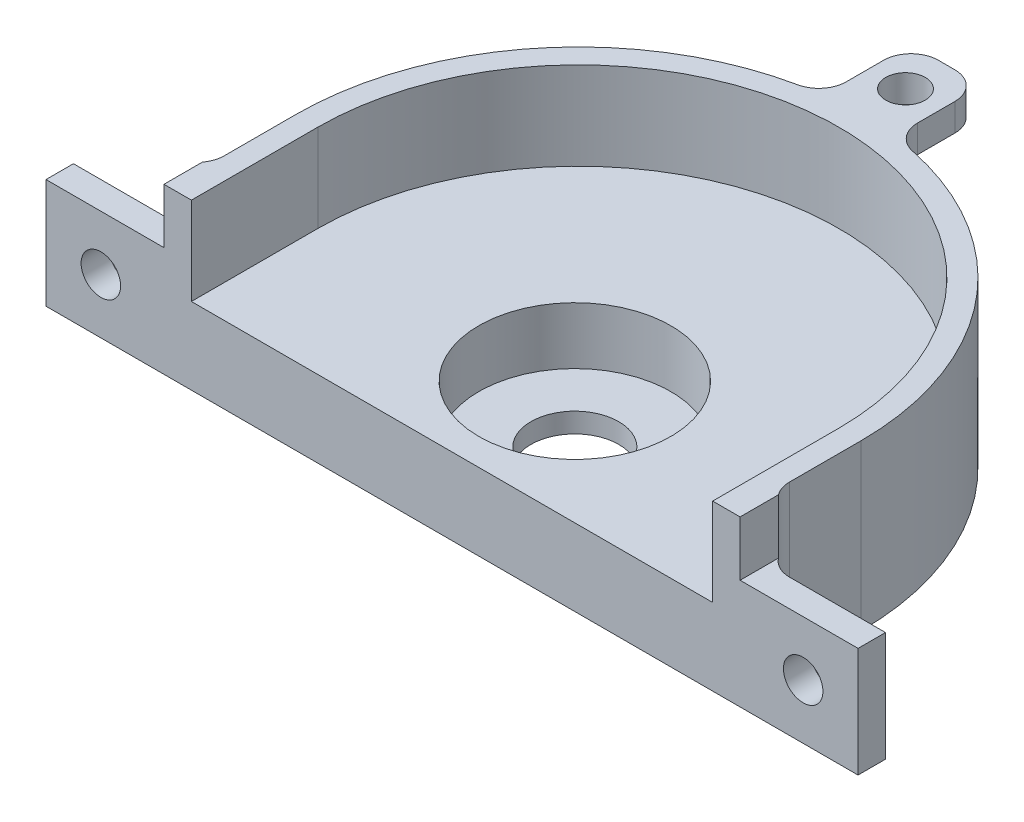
SolidWorks part; units mm, degrees
ref_plane "Front Plane" through (0, 0, 0) normal (0, 0, 1) x (1, 0, 0)
ref_plane "Top Plane" through (0, 0, 0) normal (0, 1, 0) x (1, 0, 0)
ref_plane "Right Plane" through (0, 0, 0) normal (1, 0, 0) x (0, 0, -1)
sketch "Sketch1" plane through (0, 0, 0) normal (0, 1, 0) x (1, 0, 0)
  line L0 (0, 61.1282) -> (0, -58.0946) construction
  line L1 (-60.2181, 0) -> (59.6114, 0) construction
  line L2 (-50.8, -38.1) -> (50.8, -38.1)
  line L4 (-50.8, -38.1) -> (-50.8, 38.1)
  line L5 (-50.8, 38.1) -> (50.8, 38.1)
  line L6 (50.8, -38.1) -> (50.8, 38.1)
  dimension "D1" = 76.2
  dimension "D2" = 101.6
  dimension "D3" = 50.8
extrude "Extrude1" add sketch "Sketch1" along normal blind 19.05
sketch "Sketch2" plane through (0, 19.05, 0) normal (0, 1, 0) x (1, 0, 0)
  line L1 (-50.8, -38.1) -> (50.8, -38.1) construction
  line L4 (-30.1625, -22.333) -> (-30.1625, -46.1454)
  line L5 (-30.1625, -46.1454) -> (30.1625, -46.1455)
  line L6 (30.1625, -22.3329) -> (30.1625, -46.1455)
  arc A0 (30.1625, -22.3329) -> (-30.1625, -22.333) centre (0, -22.333) ccw
  circle A1 centre (0, -22.333) radius 3.175 construction
  dimension "D2" = 60.325
  dimension "D3" = 6.35
  dimension "D1" = 15.7671
extrude "Cut-Extrude1" cut sketch "Sketch2" against normal blind 10.16
sketch "Sketch4" plane through (0, 0, 0) normal (0, 1, 0) x (1, 0, 0)
  line L0 (-30.1625, -38.1) -> (30.1625, -38.1) construction
  circle A0 centre (0, -22.7457) radius 5.08
  dimension "D2" = 10.16
  dimension "D1" = 15.3543
extrude "Cut-Extrude2" cut sketch "Sketch4" along normal through all
sketch "Sketch5" plane through (0, 19.05, 0) normal (0, 1, 0) x (1, 0, 0)
  line L0 (-50.8, -33.782) -> (-35.8775, -33.782)
  line L1 (-50.8, 38.1) -> (-50.8, -38.1) construction
  line L2 (-32.7025, -30.607) -> (-32.7025, -22.333)
  line L3 (0, -38.3038) -> (0, 44.9227) construction
  line L4 (-30.1625, -22.333) -> (-30.1625, -38.1) construction
  line L5 (-50.8, -33.782) -> (-50.8, -36.957)
  line L6 (-50.8, -36.957) -> (-30.1625, -36.957)
  line L7 (-30.1625, -22.3329) -> (-30.1625, -38.1) construction
  line L8 (-30.1625, -36.957) -> (30.1625, -36.957)
  line L9 (4.1275, 20.2865) -> (4.1275, 12.7935)
  line L10 (50.8, -36.957) -> (30.1625, -36.957)
  line L11 (50.8, -33.782) -> (50.8, -36.957)
  line L12 (32.7025, -30.607) -> (32.7025, -22.333)
  line L13 (50.8, -33.782) -> (35.8775, -33.782)
  line L14 (30.1625, -38.1) -> (50.8, -38.1) construction
  line L15 (-4.1275, 20.2865) -> (4.1275, 20.2865)
  line L16 (-4.1275, 20.2865) -> (-4.1275, 12.7935)
  arc A0 (-32.7025, -22.333) -> (-6.6563, 9.685) centre (0, -22.333) cw
  arc A1 (-32.7025, -30.607) -> (-35.8775, -33.782) centre (-35.8775, -30.607) cw
  arc A2 (30.1625, -22.3329) -> (-30.1625, -22.3329) centre (0, -22.333) ccw construction
  arc A3 (32.7025, -30.607) -> (35.8775, -33.782) centre (35.8775, -30.607) ccw
  arc A4 (32.7025, -22.333) -> (6.6563, 9.685) centre (0, -22.333) ccw
  arc A5 (-4.1275, 12.7935) -> (-6.6563, 9.685) centre (-7.3025, 12.7935) cw
  arc A6 (4.1275, 12.7935) -> (6.6563, 9.685) centre (7.3025, 12.7935) ccw
  point P37 (0, 20.2865)
  point P38 (-32.7025, -33.782)
  point P41 (32.7025, -33.782)
  dimension "D1" = 2.54
  dimension "D4" = 3.175
  dimension "D7" = 3.175
  dimension "D8" = 3.175
  dimension "D2" = 1.143
  dimension "D3" = 3.175
  dimension "D5" = 4.1275
  dimension "D6" = 7.493
extrude "Cut-Extrude3" cut sketch "Sketch5" against normal through all flip side to cut
sketch "Sketch6" plane through (0, 8.89, 0) normal (0, 1, 0) x (1, 0, 0)
  line L1 (18.4342, -35.3695) -> (26.9875, -35.3695)
  line L2 (-30.1625, -22.333) -> (-30.1625, -32.1945)
  line L3 (-26.9875, -35.3695) -> (-15.875, -35.3695)
  line L4 (30.1625, -22.333) -> (30.1625, -32.1945)
  line L5 (-30.1625, -36.957) -> (30.1625, -36.957) construction
  line L6 (15.9788, -33.4795) -> (12.2771, -19.4958)
  line L7 (-12.7, -32.1945) -> (-12.7, -22.7457)
  circle A0 centre (0, -22.7457) radius 11.1125
  arc A1 (12.2771, -19.4958) -> (-12.7, -22.7457) centre (0, -22.7457) ccw
  arc A2 (-30.1625, -22.333) -> (30.1625, -22.333) centre (0, -22.333) cw
  arc A3 (15.9788, -33.4795) -> (18.4342, -35.3695) centre (18.4342, -32.8295) ccw
  arc A4 (26.9875, -35.3695) -> (30.1625, -32.1945) centre (26.9875, -32.1945) ccw
  arc A5 (-12.7, -32.1945) -> (-15.875, -35.3695) centre (-15.875, -32.1945) cw
  arc A6 (-30.1625, -32.1945) -> (-26.9875, -35.3695) centre (-26.9875, -32.1945) ccw
  dimension "D1" = 22.225
  dimension "D2" = 1.5875
  dimension "D4" = 2.54
  dimension "D5" = 3.175
  dimension "D3" = 1.5875
extrude "Cut-Extrude4" [suppressed] cut sketch "Sketch6" against normal blind 6.604
sketch "Sketch11" plane through (0, 8.89, 0) normal (0, 1, 0) x (1, 0, 0)
  circle A0 centre (0, -22.7457) radius 11.1125
  circle A1 centre (0, -22.7457) radius 5.08 construction
  dimension "D1" = 22.225
extrude "Cut-Extrude10" cut sketch "Sketch11" against normal blind 6.604
sketch "Sketch7" plane through (0, 0, 0) normal (0, 0, 1) x (1, 0, 0)
  line L0 (0, -11.251) -> (0, 32.017) construction
  line L1 (-50.8, 19.05) -> (-30.1625, 19.05) construction
  line L2 (-35.8775, 0) -> (-35.8775, 19.05) construction
  circle A0 centre (-40.64, 6.35) radius 2.286
  circle A1 centre (40.64, 6.35) radius 2.286
  dimension "D1" = 4.572
  dimension "D2" = 4.7625
  dimension "D3" = 12.7
extrude "Cut-Extrude5" cut sketch "Sketch7" along normal through all
sketch "Sketch8" plane through (0, 19.05, 0) normal (0, 1, 0) x (1, 0, 0)
  line L0 (32.6825, -21.19) -> (47.625, -21.19)
  line L1 (-47.625, 29.61) -> (47.625, 29.61)
  line L2 (-47.625, 29.61) -> (-47.625, -21.19)
  line L3 (-47.625, -21.19) -> (-32.6825, -21.19)
  line L4 (47.625, 29.61) -> (47.625, -21.19)
  arc A0 (-6.6563, 9.685) -> (-32.7025, -22.333) centre (0, -22.333) ccw construction
  arc A4 (32.7025, -22.333) -> (6.6563, 9.685) centre (0, -22.333) ccw construction
  arc A5 (32.6825, -21.19) -> (-32.6825, -21.19) centre (0, -22.333) ccw
  dimension "D1" = 50.8
  dimension "D2" = 95.25
extrude "Cut-Extrude7" cut sketch "Sketch8" against normal through all from offset 3.175
sketch "Sketch9" plane through (0, 0, 36.957) normal (0, 0, 1) x (1, 0, 0)
  line L0 (-46.99, 0) -> (-46.99, 12.7)
  line L1 (-50.8, 0) -> (50.8, 0) construction
  line L2 (-46.99, 12.7) -> (-33.3375, 12.7)
  line L3 (-33.3375, 12.7) -> (-33.3375, 19.05)
  line L4 (-50.8, 19.05) -> (-30.1625, 19.05) construction
  line L5 (-33.3375, 19.05) -> (-50.8, 19.05)
  line L6 (-50.8, 19.05) -> (-50.8, 0)
  line L7 (-50.8, 0) -> (-46.99, 0)
  line L8 (0, -12.3541) -> (0, 33.6104) construction
  line L9 (-30.1625, 8.89) -> (-30.1625, 19.05) construction
  line L10 (50.8, 0) -> (46.99, 0)
  line L11 (50.8, 19.05) -> (50.8, 0)
  line L12 (33.3375, 19.05) -> (50.8, 19.05)
  line L13 (33.3375, 12.7) -> (33.3375, 19.05)
  line L14 (46.99, 12.7) -> (33.3375, 12.7)
  line L15 (46.99, 0) -> (46.99, 12.7)
  circle A0 centre (-40.64, 6.35) radius 2.286 construction
  dimension "D1" = 6.35
  dimension "D2" = 6.35
  dimension "D3" = 3.175
extrude "Cut-Extrude8" cut sketch "Sketch9" against normal through all
sketch "Sketch10" plane through (0, 0, 0) normal (0, 1, 0) x (1, 0, 0)
  line L0 (4.1275, 20.2865) -> (-4.1275, 20.2865) construction
  circle A0 centre (0, 15.524) radius 2.286
  dimension "D1" = 4.572
  dimension "D2" = 4.7625
extrude "Cut-Extrude9" cut sketch "Sketch10" along normal through all
fillet "Fillet2" radius 3.175 2 edges at (-4.1275, 17.4625, -20.2865) (4.1275, 17.4625, -20.2865)
fillet "Fillet3" [suppressed] radius 6.35
